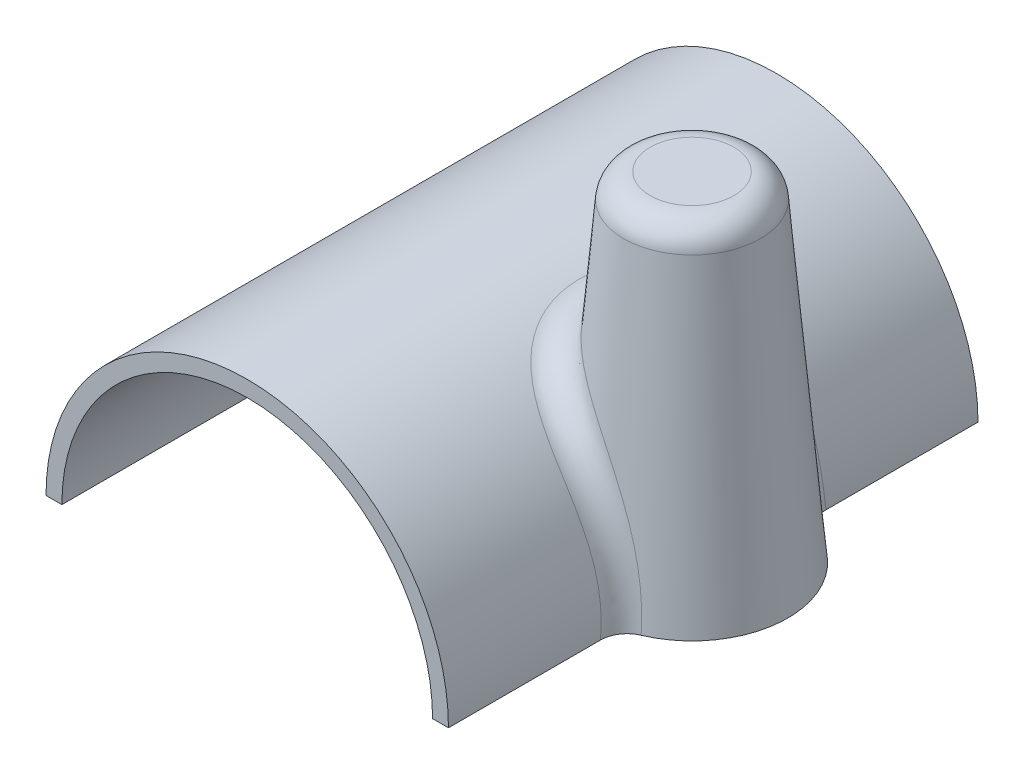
SolidWorks part; units mm, degrees
ref_plane "Front Plane" through (0, 0, 0) normal (0, 0, 1) x (1, 0, 0)
ref_plane "Top Plane" through (0, 0, 0) normal (0, 1, 0) x (1, 0, 0)
ref_plane "Right Plane" through (0, 0, 0) normal (1, 0, 0) x (0, 0, -1)
sketch "Sketch1" plane through (0, 0, 0) normal (0, 0, 1) x (1, 0, 0)
  line L0 (-19, 0) -> (19, 0) construction
  arc A0 (19, 0) -> (-19, 0) centre (0, 0) ccw
  dimension "D1" = 38
ref_plane "Plane1" through (0, 32, 0) normal (0, 1, 0) x (-1, 0, 0)
sketch "Sketch2" plane through (0, 32, 0) normal (0, 1, 0) x (-1, 0, 0)
  line L2 (19, 0) -> (-19, 0) construction
  line L3 (0, 17.6) -> (0, -17.6) construction
  circle A0 centre (-17, -25) radius 6.25
  dimension "D3" = 12.5
  dimension "D2" = 17
  dimension "D1" = 25
surface "Surface-Extrude1" sketch "Sketch1" parameters "D1"=50
surface "Surface-Extrude2" sketch "Sketch2" parameters "D3"=5
surface "Surface-Plane1"
surface "Surface-Trim1"
curve "Curve1"
curve "Curve2"
surface "Surface-Plane2"
surface "Surface-Plane3"
surface "Surface-Plane4"
surface "Surface-Knit2"
fillet "Fillet2" radius 2.5 2 edges at (9.3968, 16.5136, -24.8392) (17, 32, -18.75)
shell "Shell1" thickness 1.5
